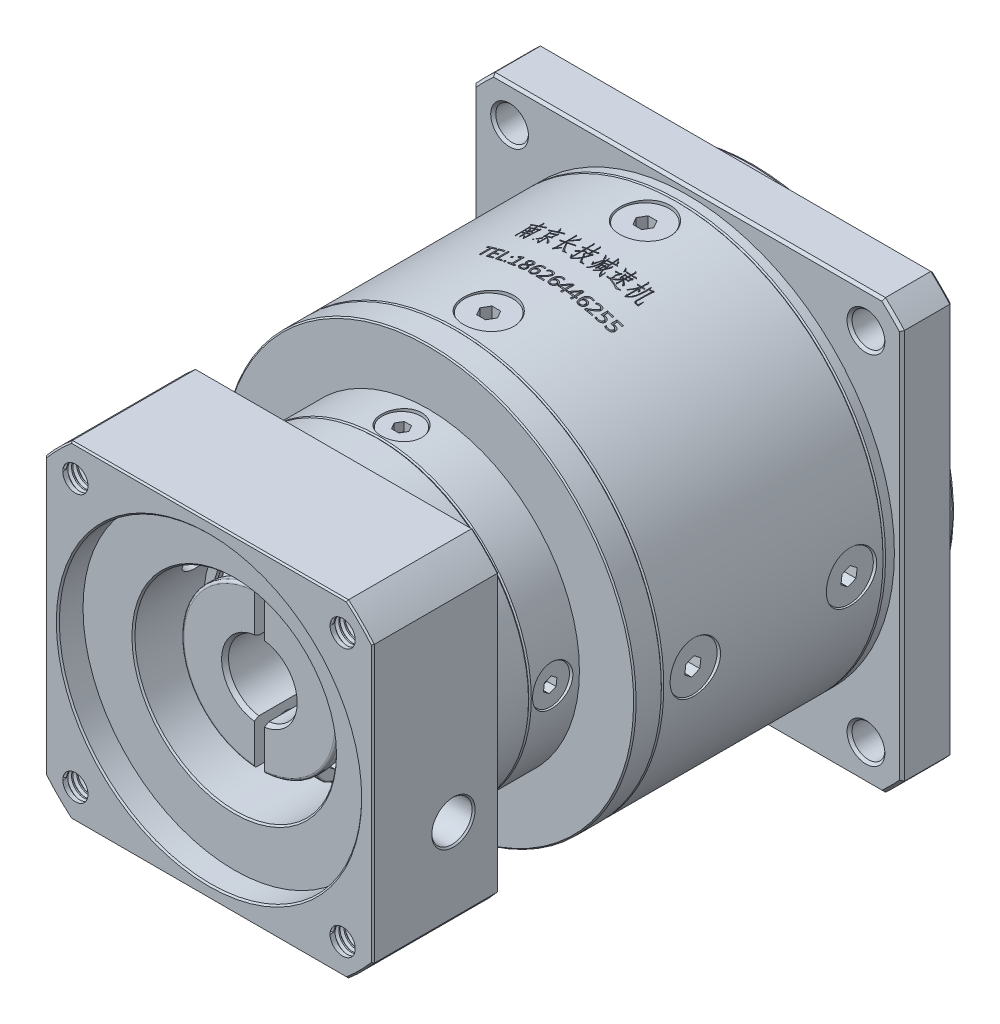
SolidWorks part; units mm, degrees
ref_plane "前视基准面" through (0, 0, 0) normal (0, 0, 1) x (1, 0, 0)
ref_plane "上视基准面" through (0, 0, 0) normal (0, 1, 0) x (1, 0, 0)
ref_plane "右视基准面" through (0, 0, 0) normal (1, 0, 0) x (0, 0, -1)
imported_body "14-60-75-M6-2-solid1"
imported_body "14-60-75-M6-2-solid2"
imported_body "14-60-75-M6-2-solid3"
imported_body "14-60-75-M6-2-solid4"
imported_body "14-60-75-M6-2-solid5"
imported_body "ZF80-K15-L2-F60-10-solid1"
imported_body "ZF80-K15-L2-F60-10-solid2"
imported_body "ZF80-K15-L2-F60-10-solid3"
imported_body "ZF80-K15-L2-F60-10-solid4"
imported_body "ZF80-K15-L2-F60-10-solid5"
imported_body "ZF80-K15-L2-F60-10-solid6"
imported_body "ZF80-K15-L2-F60-10-solid7"
imported_body "ZF80-K15-L2-F60-10-solid8"
imported_body "ZF80-K15-L2-F60-10-solid9"
imported_body "ZF80-K15-L2-F60-10-solid10"
imported_body "ZF80-K15-L2-F60-10-solid11"
imported_body "ZF80-K15-L2-F60-10-solid12"
imported_body "ZF80-K15-L2-F60-10-solid13"
sketch "草图1" plane through (0, 0, -55.1227) normal (0, 0, -1) x (-1, 0, 0)
  circle A0 centre (70.1476, 22.6734) radius 10.9754
  dimension "D1" = 21.9507
extrude "凸台-拉伸1" add sketch "草图1" along normal blind 5
